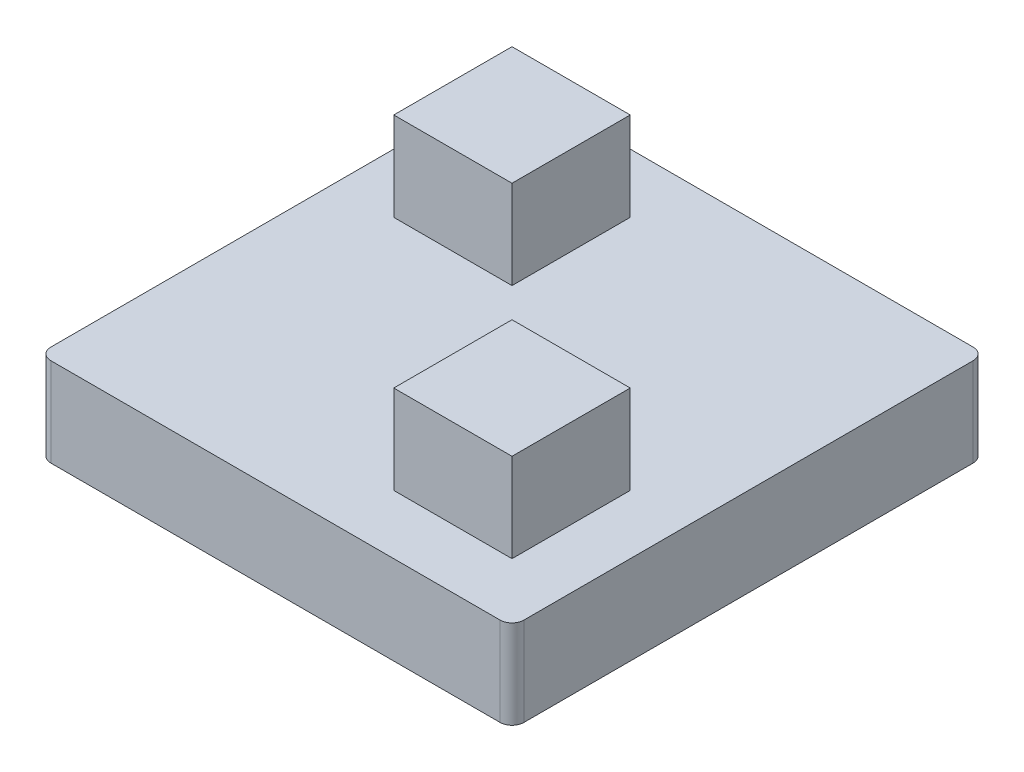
SolidWorks part; units mm, degrees
ref_plane "Front Plane" through (0, 0, 0) normal (0, 0, 1) x (1, 0, 0)
ref_plane "Top Plane" through (0, 0, 0) normal (0, 1, 0) x (1, 0, 0)
ref_plane "Right Plane" through (0, 0, 0) normal (1, 0, 0) x (0, 0, -1)
sketch " Base Sketch" plane through (0, 0, 0) normal (0, 1, 0) x (1, 0, 0)
  line L0 (-50.8, -50.8) -> (50.8, 50.8) construction
  line L1 (-50.8, 50.8) -> (50.8, 50.8)
  line L2 (-50.8, 50.8) -> (-50.8, -50.8)
  line L3 (-50.8, -50.8) -> (50.8, -50.8)
  line L4 (50.8, 50.8) -> (50.8, -50.8)
  dimension "D1" = 101.6
  dimension "D2" = 101.6
extrude "Base Sketch" add sketch " Base Sketch" along normal blind 19.05
sketch "Boss 1 Sketch" plane through (0, 19.05, 0) normal (0, 1, 0) x (-1, 0, 0)
  line L1 (-38.1, 38.1) -> (-12.7, 38.1)
  line L2 (-38.1, 38.1) -> (-38.1, 12.7)
  line L3 (-38.1, 12.7) -> (-12.7, 12.7)
  line L4 (-12.7, 38.1) -> (-12.7, 12.7)
  dimension "D1" = 25.4
  dimension "D2" = 25.4
  dimension "D3" = 12.7
  dimension "D4" = 12.7
extrude "Extrude2" add sketch "Boss 1 Sketch" along normal blind 19.05
sketch "Sketch3" plane through (0, 19.05, 0) normal (0, 1, 0) x (-1, 0, 0)
  line L1 (12.7, -38.1) -> (38.1, -38.1)
  line L2 (12.7, -38.1) -> (12.7, -12.7)
  line L3 (12.7, -12.7) -> (38.1, -12.7)
  line L4 (38.1, -38.1) -> (38.1, -12.7)
  dimension "D1" = 25.4
  dimension "D2" = 25.4
  dimension "D3" = 12.7
  dimension "D4" = 12.7
extrude "Extrude3" add sketch "Sketch3" along normal up to surface (19.05 mm away)
fillet "Fillet2" radius 2.54 4 edges at (-50.8, 9.525, -50.8) (50.8, 9.525, -50.8) (50.8, 9.525, 50.8) (-50.8, 9.525, 50.8)
